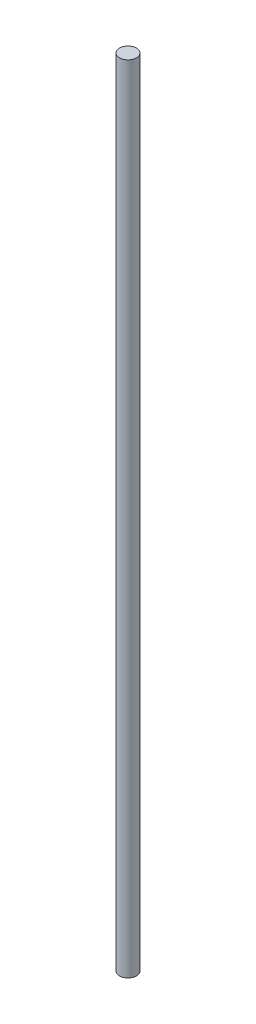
SolidWorks part; units mm, degrees
ref_plane "Front Plane" through (0, 0, 0) normal (0, 0, 1) x (1, 0, 0)
ref_plane "Top Plane" through (0, 0, 0) normal (0, 1, 0) x (1, 0, 0)
ref_plane "Right Plane" through (0, 0, 0) normal (1, 0, 0) x (0, 0, -1)
sketch "Sketch1" plane through (0, 0, 0) normal (0, 1, 0) x (1, 0, 0)
  circle A0 centre (-18.56, 5.7001) radius 4
  dimension "D1" = 8
extrude "Boss-Extrude1" add sketch "Sketch1" along normal blind 375 contours A0
